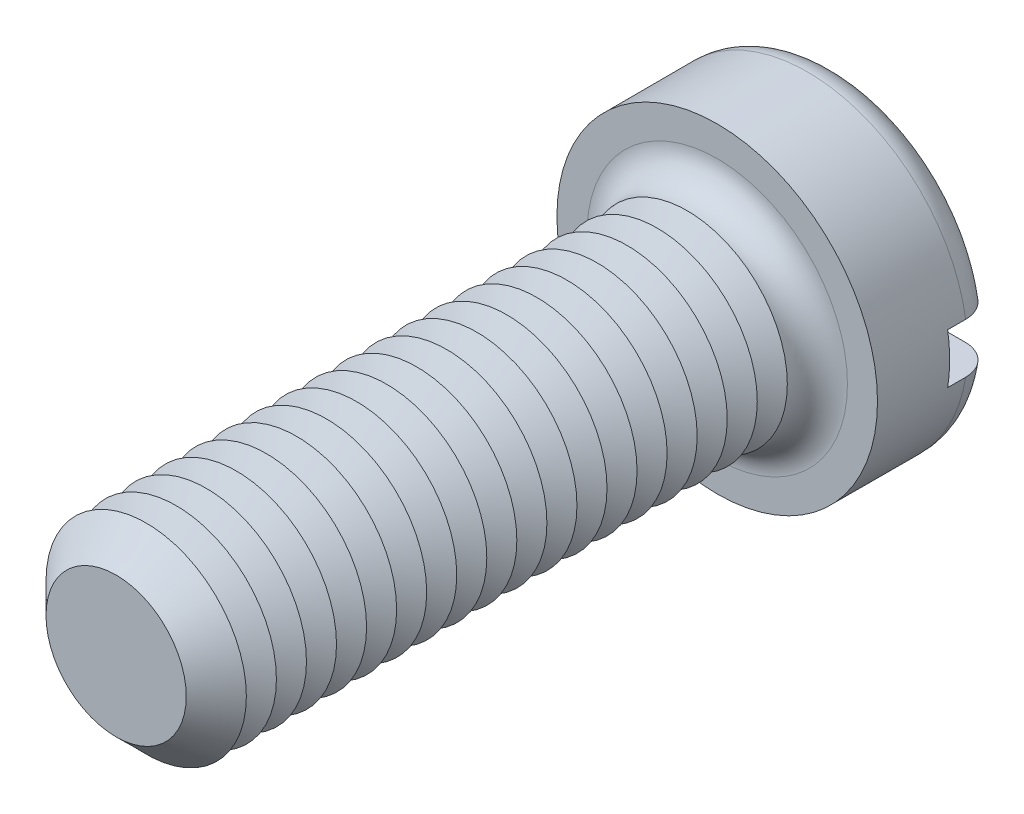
SolidWorks part; units mm, degrees
ref_plane "Front Plane" through (0, 0, 0) normal (0, 0, 1) x (1, 0, 0)
ref_plane "Top Plane" through (0, 0, 0) normal (0, 1, 0) x (1, 0, 0)
ref_plane "Right Plane" through (0, 0, 0) normal (1, 0, 0) x (0, 0, -1)
sketch "Sketch3" plane through (0, 0, 0) normal (0, 0, 1) x (1, 0, 0)
  circle A0 centre (0, 0) radius 8
  dimension "D1" = 16
extrude "Boss-Extrude2" add sketch "Sketch3" against normal blind 6
sketch "Sketch4" plane through (0, 0, 0) normal (0, 0, 1) x (1, 0, 0)
  circle A0 centre (0, 0) radius 5
  dimension "D1" = 10
extrude "Boss-Extrude3" add sketch "Sketch4" along normal blind 30
fillet "Fillet1" radius 1.5 2 edges at (8, 0, -6) (5, 0, 0)
chamfer "Chamfer1" distance 1.5 angle 45 1 edges at (5, 0, 30)
sketch "Sketch5" plane through (0, 0, 0) normal (1, 0, 0) x (0, 0, -1)
  line L0 (1.6944, 0) -> (-7.6738, 0) construction
sketch "Sketch6" plane through (0, 0, 0) normal (1, 0, 0) x (0, 0, -1)
  line L0 (-1.5, 5) -> (-2.25, 3.701)
  line L1 (-2.25, 3.701) -> (-3, 5)
  line L2 (-1.5, 5) -> (-28.5, 5) construction
  line L3 (-3, 5) -> (-1.5, 5)
  dimension "D1" = 1.5
revolve "Cut-Revolve1" cut sketch "Sketch6" angle 360 about L0
pattern_linear "LPattern1" count 18 spacing 1.5 along (0, 0, 1) of "Cut-Revolve1"
sketch "Sketch8" plane through (0, 0, -6) normal (0, 0, -1) x (-1, 0, 0)
  line L1 (8, -1.25) -> (-8, -1.25)
  line L2 (8, -1.25) -> (8, 1.25)
  line L3 (8, 1.25) -> (-8, 1.25)
  line L4 (-8, -1.25) -> (-8, 1.25)
  line L5 (8, -1.25) -> (-8, 1.25) construction
  line L6 (8, 1.25) -> (-8, -1.25) construction
  point P0 (0, 0)
  dimension "D1" = 16
  dimension "D2" = 2.5
extrude "Cut-Extrude1" cut sketch "Sketch8" against normal blind 2.4
